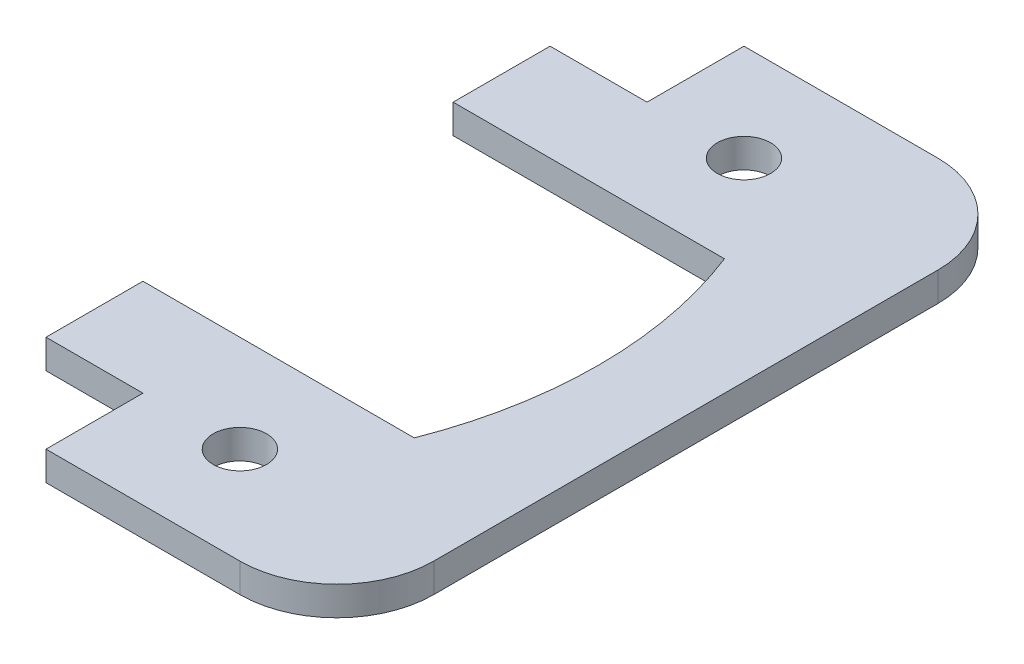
SolidWorks part; units mm, degrees
ref_plane "Front Plane" through (0, 0, 0) normal (0, 0, 1) x (1, 0, 0)
ref_plane "Top Plane" through (0, 0, 0) normal (0, 1, 0) x (1, 0, 0)
ref_plane "Right Plane" through (0, 0, 0) normal (1, 0, 0) x (0, 0, -1)
sketch "Sketch1" plane through (0, 0, 0) normal (0, 1, 0) x (1, 0, 0)
  line L0 (0, 0) -> (102.8544, 0) construction
  line L1 (13, -16) -> (40.9878, -16)
  line L2 (13, 16) -> (40.9878, 16)
  line L3 (0, 16) -> (102.8544, 16) construction
  line L4 (0, -16) -> (102.8544, -16) construction
  line L5 (23, -26) -> (13, -26)
  line L6 (13, -26) -> (13, -16)
  line L7 (23, 26) -> (23, 36)
  line L8 (23, 36) -> (43, 36)
  line L9 (53, 26) -> (53, -26)
  line L10 (43, -36) -> (23, -36)
  line L11 (23, -36) -> (23, -26)
  line L12 (23, 26) -> (13, 26)
  line L13 (13, 26) -> (13, 16)
  arc A0 (40.9878, -16) -> (40.9878, 16) centre (0, 0) ccw
  circle A1 centre (33, 26) radius 2.75
  circle A2 centre (33, -26) radius 2.75
  arc A3 (53, 26) -> (43, 36) centre (43, 26) ccw
  arc A4 (43, -36) -> (53, -26) centre (43, -26) ccw
  point P25 (53, 36)
  point P28 (53, -36)
  dimension "D3" = 44
  dimension "D13" = 5.5
  dimension "D14" = 5.5
  dimension "D15" = 10
  dimension "D16" = 10
  dimension "D17" = 10
  dimension "D18" = 10
  dimension "D19" = 10
  dimension "D4" = 30
  dimension "D5" = 10
  dimension "D6" = 30
  dimension "D7" = 10
  dimension "D8" = 10
  dimension "D9" = 10
  dimension "D10" = 53
  dimension "D11" = 10
  dimension "D12" = 10
  dimension "D1" = 16
  dimension "D2" = 16
extrude "Extrude1" add sketch "Sketch1" along normal blind 3
